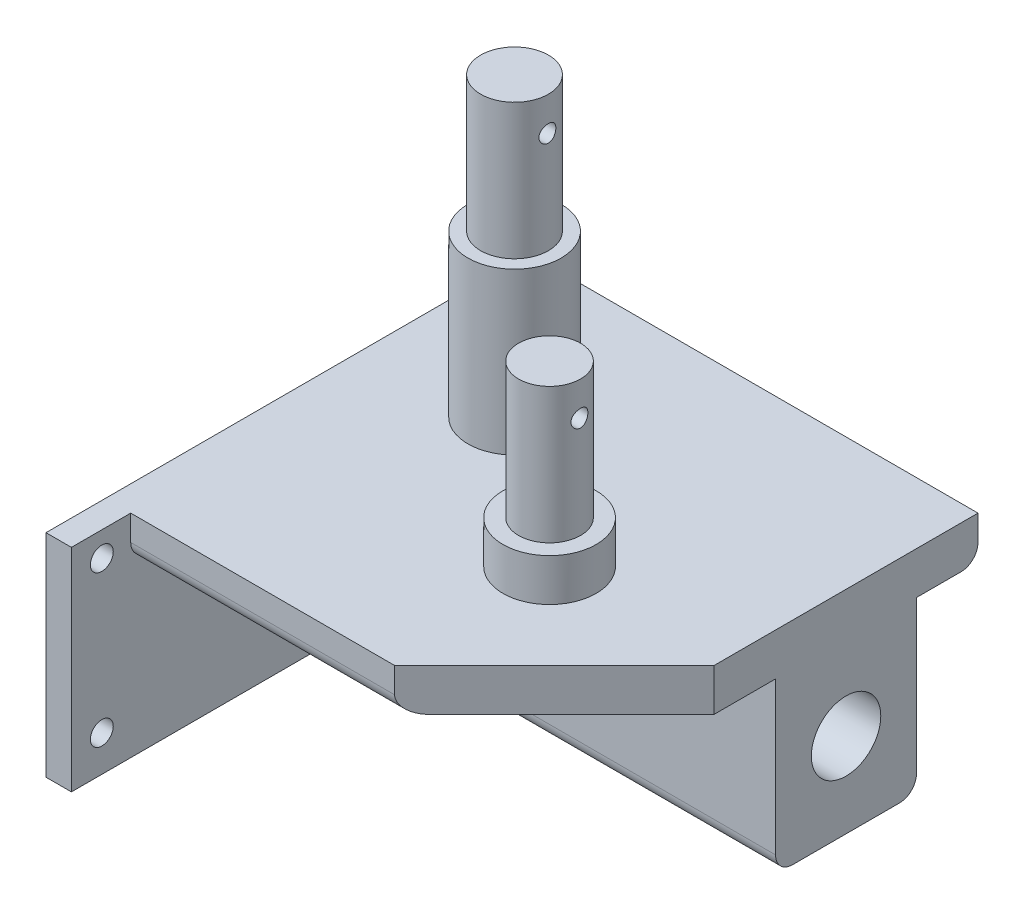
SolidWorks part; units mm, degrees
ref_plane "Front Plane" through (0, 0, 0) normal (0, 0, 1) x (1, 0, 0)
ref_plane "Top Plane" through (0, 0, 0) normal (0, 1, 0) x (1, 0, 0)
ref_plane "Right Plane" through (0, 0, 0) normal (1, 0, 0) x (0, 0, -1)
sketch "Sketch1" plane through (0, 0, 0) normal (0, 1, 0) x (1, 0, 0)
  line L0 (5.5296, -25.619) -> (24.381, -6.7676)
  line L1 (-25.619, -25.619) -> (5.5296, -25.619)
  line L2 (-25.619, -25.619) -> (-25.619, 24.381)
  line L3 (-25.619, 24.381) -> (24.381, 24.381)
  line L4 (24.381, -6.7676) -> (24.381, 24.381)
  line L5 (-25.619, -25.619) -> (24.381, 24.381) construction
  line L6 (-25.619, 24.381) -> (15.9599, -15.1887) construction
  circle A0 centre (-13.119, 6.381) radius 8 construction
  circle A1 centre (3.381, -9.119) radius 8 construction
  point P0 (0, 0)
extrude "Boss-Extrude1" add sketch "Sketch1" along normal blind 5
sketch "Sketch2" plane through (0, 0, 0) normal (0, -1, 0) x (1, 0, 0)
  line L0 (24.381, -8.8067) -> (-25.619, -8.8067) construction
  line L1 (24.381, 6.7676) -> (24.381, -24.381) construction
  line L2 (-25.619, -24.381) -> (-25.619, 25.619) construction
  line L4 (-25.619, -0.4941) -> (24.381, -0.4941)
  line L5 (-25.619, -0.4941) -> (-25.619, -17.1193)
  line L6 (-25.619, -17.1193) -> (24.381, -17.1193)
  line L7 (24.381, -0.4941) -> (24.381, -17.1193)
  line L8 (-25.619, -0.4941) -> (24.381, -17.1193) construction
  line L9 (-25.619, -17.1193) -> (24.381, -0.4941) construction
  point P6 (-0.619, -8.8067)
extrude "Boss-Extrude2" add sketch "Sketch2" along normal blind 20
sketch "Sketch3" plane through (24.381, 0, 0) normal (1, 0, 0) x (0, 0, -1)
  line L0 (-6.7676, 5) -> (24.381, 5) construction
  circle A0 centre (8.8067, -10) radius 4.1
  point P13 (8.8067, -10)
extrude "Cut-Extrude1" cut sketch "Sketch3" against normal blind 30
fillet "Fillet1" radius 2 4 edges at (-0.619, 0, -24.381) (-10.0447, 0, 25.619) (-0.619, -20, -17.1193) (-0.619, -20, -0.4941)
sketch "Sketch5" plane through (0, 5, 0) normal (0, 1, 0) x (1, 0, 0)
  circle A0 centre (-12.7876, 6.8496) radius 8 construction
  circle A1 centre (4.5599, -6.3651) radius 8 construction
  circle A2 centre (-12.7876, 6.8496) radius 5.5
  circle A3 centre (4.5599, -6.3651) radius 5.5
  dimension "D1" = 16
  dimension "D2" = 16
  dimension "D3" = 11
  dimension "D4" = 11
extrude "Boss-Extrude3" add sketch "Sketch5" along normal blind 5
sketch "Sketch11" plane through (0, 10, 0) normal (0, 1, 0) x (1, 0, 0)
  circle A0 centre (4.5599, -6.3651) radius 3.6587
  circle A1 centre (4.5599, -6.3651) radius 5.5 construction
extrude "Boss-Extrude7" add sketch "Sketch11" along normal blind 16
sketch "Sketch12" plane through (0, 10, 0) normal (0, 1, 0) x (1, 0, 0)
  circle A0 centre (-12.7876, 6.8496) radius 5.5 construction
  circle A1 centre (-12.7876, 6.8496) radius 5.5
extrude "Boss-Extrude8" add sketch "Sketch12" along normal blind 14
sketch "Sketch13" plane through (0, 24, 0) normal (0, 1, 0) x (1, 0, 0)
  circle A0 centre (-12.7876, 6.8496) radius 4
  circle A1 centre (-12.7876, 6.8496) radius 5.5 construction
  dimension "D1" = 8
extrude "Boss-Extrude9" add sketch "Sketch13" along normal blind 16
sketch "Sketch14" plane through (-25.619, 0, 0) normal (-1, 0, 0) x (0, 0, 1)
  line L0 (-12.3496, 24) -> (-1.3496, 24) construction
  line L1 (0.8651, 10) -> (11.8651, 10) construction
  circle A0 centre (-6.8496, 36) radius 1
  circle A1 centre (6.3651, 22) radius 1
  point P12 (0, 0)
  point P13 (6.3651, 10)
  point P14 (0, 0)
  point P15 (-6.8496, 24)
  dimension "D1" = 2
  dimension "D2" = 2
  dimension "D3" = 12
  dimension "D4" = 12
extrude "Cut-Extrude3" cut sketch "Sketch14" against normal through all both and the other way through all
sketch "Sketch8" plane through (-25.619, 0, 0) normal (-1, 0, 0) x (0, 0, 1)
  line L0 (32.7919, 5) -> (-48.7637, 5) construction
  line L1 (-24.381, 5) -> (32.619, 5)
  line L2 (-24.381, 5) -> (-24.381, -20)
  line L3 (32.619, 5) -> (32.619, -20)
  line L4 (-24.381, -20) -> (32.619, -20)
  line L6 (-2.4941, -20) -> (-15.1193, -20) construction
  line L7 (25.619, 5) -> (25.619, 2) construction
  point P12 (25.619, 3.5)
  dimension "D1" = 0
  dimension "D2" = 7
extrude "Boss-Extrude5" add sketch "Sketch8" along normal blind 3
sketch "Sketch9" plane through (-25.619, 0, 0) normal (1, 0, 0) x (0, 0, -1)
  circle A0 centre (21.1168, -3.149) radius 1.35
  circle A1 centre (21.1168, -15.7498) radius 1.35
  circle A2 centre (-29.0299, -15.7498) radius 1.35
  circle A3 centre (-29.0299, 2.0917) radius 1.35
  point P8 (-29.0299, -15.7498)
  point P9 (21.1168, -15.7498)
extrude "Cut-Extrude2" cut sketch "Sketch9" against normal through all both and the other way through all
equation "\"screws\"= 2.7mm"
equation "\"D1@Sketch9\"=\"screws\""
equation "\"D2@Sketch9\"=\"screws\""
equation "\"D3@Sketch9\"=\"screws\""
equation "\"D4@Sketch9\"=\"screws\""
equation "\"barra\"= 8mm"
equation "\"a\"= 12.5"
equation "\"b\"= 18"
equation "\"c\"= 29"
equation "\"d\"= 16.5"
equation "\"D6@Sketch1\"=\"a\""
equation "\"D5@Sketch1\"=\"b\""
equation "\"D8@Sketch1\"=\"d\""
equation "\"D7@Sketch1\"=\"c\""
equation "\"D1@Sketch3\"=\"barra\"+0.2"
